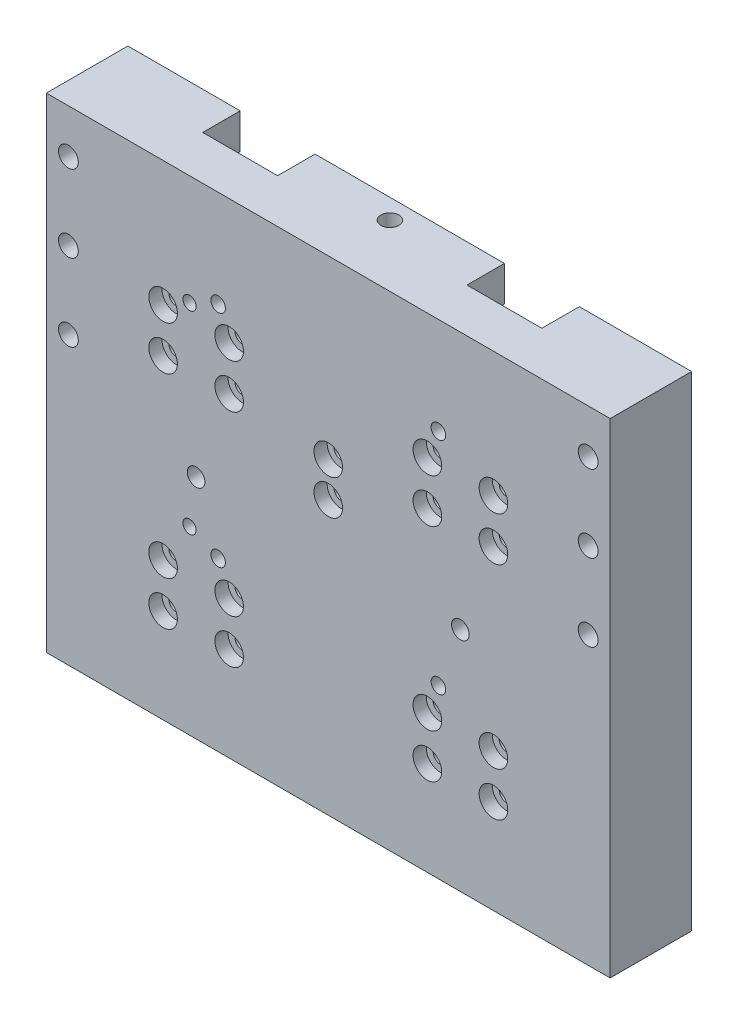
SolidWorks part; units mm, degrees
ref_plane "Front Plane" through (0, 0, 0) normal (0, 0, 1) x (1, 0, 0)
ref_plane "Top Plane" through (0, 0, 0) normal (0, 1, 0) x (1, 0, 0)
ref_plane "Right Plane" through (0, 0, 0) normal (1, 0, 0) x (0, 0, -1)
sketch "Sketch1" plane through (0, 0, 0) normal (0, 0, 1) x (1, 0, 0)
  line L1 (-64, -55) -> (64, -55)
  line L2 (-64, -55) -> (-64, 55)
  line L3 (-64, 55) -> (64, 55)
  line L4 (64, -55) -> (64, 55)
  line L5 (-64, -55) -> (64, 55) construction
  line L6 (-64, 55) -> (64, -55) construction
  point P0 (0, 0)
  dimension "D1" = 128
  dimension "D2" = 110
extrude "Boss-Extrude1" add sketch "Sketch1" along normal blind 18.5
sketch "Sketch2" plane through (0, 0, 0) normal (0, 0, -1) x (-1, 0, 0)
  line L0 (-64, 55) -> (64, 55) construction
  line L1 (-49, -52) -> (49, -52)
  line L2 (-49, -52) -> (-49, 47)
  line L3 (-49, 47) -> (49, 47)
  line L4 (49, -52) -> (49, 47)
  line L5 (64, -55) -> (-64, -55) construction
  line L6 (64, 55) -> (64, -55) construction
  line L7 (-64, -55) -> (-64, 55) construction
  dimension "D1" = 8
  dimension "D2" = 3
  dimension "D3" = 15
  dimension "D4" = 15
extrude "Cut-Extrude1" cut sketch "Sketch2" against normal blind 9.5
sketch "Sketch4" plane through (0, 55, 0) normal (0, 1, 0) x (1, 0, 0)
  line L0 (-64, 0) -> (64, 0) construction
  line L1 (-38.5, 0) -> (-21.5, 0)
  line L2 (-38.5, 0) -> (-38.5, -8.5)
  line L3 (-38.5, -8.5) -> (-21.5, -8.5)
  line L4 (-21.5, 0) -> (-21.5, -8.5)
  line L5 (-64, -18.5) -> (-64, 0) construction
  line L6 (21.5, 0) -> (38.5, 0)
  line L7 (21.5, 0) -> (21.5, -8.5)
  line L8 (21.5, -8.5) -> (38.5, -8.5)
  line L9 (38.5, 0) -> (38.5, -8.5)
  line L10 (64, -18.5) -> (64, 0) construction
  dimension "D1" = 17
  dimension "D2" = 8.5
  dimension "D3" = 25.5
  dimension "D4" = 25.5
extrude "Cut-Extrude2" cut sketch "Sketch4" against normal through all
hole_wizard "CBORE for M4 SHCS0" positions "Sketch14" profile "Sketch13" counterbore size "M4" standard "ANSI Metric"
sketch "Sketch14" plane through (0, 0, 0) normal (0, 0, -1) x (-1, 0, 0)
  line L0 (-64, -55) -> (-64, 55) construction
  line L1 (-64, 55) -> (-38.5, 55) construction
  point P0 (-59, 45)
  point P6 (-59, 27.5)
  point P8 (-59, 10)
  dimension "D1" = 5
  dimension "D2" = 5
  dimension "D3" = 5
  dimension "D4" = 10
  dimension "D5" = 27.5
  dimension "D6" = 45
sketch "Sketch13" plane through (59, 45, 0) normal (1, 0, 0) x (0, 1, 0)
  line L0 (0, 0) -> (0, 18.5)
  line L1 (0, 18.5) -> (2.25, 18.5)
  line L3 (2.25, 18.5) -> (2.25, 4)
  line L4 (2.25, 4) -> (4, 4)
  line L5 (4, 4) -> (4, 0)
  line L7 (4, 0) -> (0, 0)
  line L11 (0, -6.35) -> (0, 107.95) construction
  dimension "Thru Hole Dia." = 4.5
  dimension "Thru Hole Depth" = 18.5
  dimension "C'Bore Dia." = 8
  dimension "C'Bore Depth" = 4
mirror "Mirror1" about plane through (0, 0, 0) normal (1, 0, 0) of "CBORE for M4 SHCS0"
fillet "Fillet1" radius 4 4 edges at (-49, -52, 4.75) (-49, 47, 4.75) (49, 47, 4.75) (49, -52, 4.75)
hole_wizard "M4x0.7 Tapped Hole4" positions "Sketch24" profile "Sketch23" tap size "M4x0.7" standard "ANSI Metric"
sketch "Sketch24" plane through (0, 0, 18.5) normal (0, 0, 1) x (1, 0, 0)
  point P0 (-25, 33)
  point P3 (25, 33)
  point P6 (25, -17)
  point P9 (-25, -17)
sketch "Sketch23" plane through (-25, 33, 18.5) normal (1, 0, 0) x (0, -1, 0)
  line L0 (0, 0) -> (0, 18.5)
  line L1 (0, 18.5) -> (1.65, 18.5)
  line L2 (1.65, 18.5) -> (1.65, 0)
  line L5 (1.65, 0) -> (0, 0)
  line L11 (0, -6.35) -> (0, 107.95) construction
  dimension "Thru Tap Drill Dia." = 3.3
  dimension "Thru Tap Drill Depth" = 18.5
hole_wizard "CBORE for M3 SHCS3" positions "Sketch30" profile "Sketch29" counterbore size "M3" standard "ANSI Metric"
sketch "Sketch30" plane through (0, 0, 18.5) normal (0, 0, 1) x (1, 0, 0)
  point P0 (0, 15)
  point P3 (0, 7)
sketch "Sketch29" plane through (0, 15, 18.5) normal (1, 0, 0) x (0, -1, 0)
  line L0 (0, 0) -> (0, 18.5)
  line L1 (0, 18.5) -> (1.7, 18.5)
  line L3 (1.7, 18.5) -> (1.7, 3)
  line L4 (1.7, 3) -> (3.25, 3)
  line L5 (3.25, 3) -> (3.25, 0)
  line L7 (3.25, 0) -> (0, 0)
  line L11 (0, -6.35) -> (0, 107.95) construction
  dimension "Thru Hole Dia." = 3.4
  dimension "Thru Hole Depth" = 18.5
  dimension "C'Bore Dia." = 6.5
  dimension "C'Bore Depth" = 3
sketch "Sketch31" plane through (0, 0, 9.5) normal (0, 0, -1) x (-1, 0, 0)
  line L0 (-15, 45) -> (15, 45) construction
  line L1 (-45, -50) -> (-15, -50)
  line L2 (-45, -50) -> (-45, 45)
  line L3 (-45, 45) -> (-15, 45)
  line L4 (-15, -50) -> (-15, 45)
  line L5 (15, -50) -> (45, -50)
  line L6 (15, -50) -> (15, 45)
  line L7 (15, 45) -> (45, 45)
  line L8 (45, -50) -> (45, 45)
  line L9 (-15, -50) -> (15, -50) construction
  line L10 (-64, -55) -> (-64, 55) construction
  line L11 (64, 55) -> (64, -55) construction
  line L12 (21.5, -55) -> (-21.5, -55) construction
  dimension "D1" = 30
  dimension "D2" = 30
  dimension "D3" = 95
  dimension "D4" = 19
  dimension "D5" = 19
  dimension "D6" = 5
extrude "Cut-Extrude3" [suppressed] cut sketch "Sketch31" against normal blind 1
hole_wizard "CBORE for M3 SHCS4" positions "Sketch41" profile "Sketch40" counterbore size "M3" standard "ANSI Metric"
sketch "Sketch41" plane through (0, 0, 18.5) normal (0, 0, 1) x (1, 0, 0)
  point P0 (-37.5, 26.6)
  point P3 (-37.5, 16.6)
  point P6 (-22.5, 26.6)
  point P9 (-22.5, 16.6)
  point P12 (-37.5, -23.6)
  point P15 (-37.5, -33.6)
  point P18 (-22.5, -33.6)
  point P21 (-22.5, -23.6)
  point P24 (22.5, -23.6)
  point P27 (22.5, -33.6)
  point P30 (37.5, -33.6)
  point P33 (37.5, -23.6)
  point P36 (37.5, 16.6)
  point P39 (37.5, 26.6)
  point P42 (22.5, 26.6)
  point P45 (22.5, 16.6)
sketch "Sketch40" plane through (-37.5, 26.6, 18.5) normal (1, 0, 0) x (0, -1, 0)
  line L0 (0, 0) -> (0, 18.5)
  line L1 (0, 18.5) -> (1.7, 18.5)
  line L3 (1.7, 18.5) -> (1.7, 3)
  line L4 (1.7, 3) -> (3.25, 3)
  line L5 (3.25, 3) -> (3.25, 0)
  line L7 (3.25, 0) -> (0, 0)
  line L11 (0, -6.35) -> (0, 107.95) construction
  dimension "Thru Hole Dia." = 3.4
  dimension "Thru Hole Depth" = 18.5
  dimension "C'Bore Dia." = 6.5
  dimension "C'Bore Depth" = 3
fillet "Fillet2" [suppressed] radius 4
fillet "Fillet3" [suppressed] radius 4
fillet "Fillet4" [suppressed] radius 4
fillet "Fillet5" [suppressed] radius 4
hole_wizard "Ø4.1 (4.1) Diameter Hole1" positions "Sketch43" profile "Sketch42" hole size "Ø4.1" standard "ANSI Metric"
sketch "Sketch43" plane through (0, 55, 0) normal (0, 1, 0) x (1, 0, 0)
  line L0 (21.5, 0) -> (-21.5, 0) construction
  line L1 (0, -4.5) -> (0, 0) construction
  point P0 (0, -4.5)
  dimension "D1" = 4.5
sketch "Sketch42" plane through (0, 55, 4.5) normal (1, 0, 0) x (0, 0, 1)
  line L0 (0, 0) -> (0, 8)
  line L1 (0, 8) -> (2.05, 8)
  line L2 (2.05, 8) -> (2.05, 0)
  line L5 (2.05, 0) -> (0, 0)
  line L11 (0, -6.35) -> (0, 107.95) construction
  dimension "Thru Hole Dia." = 4.1
  dimension "Thru Hole Depth" = 8
hole_wizard "Ø3.0 (3) Diameter Hole1" positions "Sketch45" profile "Sketch44" hole size "Ø3.0" standard "ANSI Metric"
sketch "Sketch45" plane through (0, 0, 18.5) normal (0, 0, 1) x (1, 0, 0)
  line L0 (-31.5, 30) -> (-31.5, -14) construction
  line L2 (64, 55) -> (-64, 55) construction
  point P0 (-31.5, 30)
  point P2 (-31.5, -14)
  dimension "D1" = 31.5
  dimension "D2" = 25
  dimension "D3" = 44
sketch "Sketch44" plane through (-31.5, 30, 18.5) normal (1, 0, 0) x (0, -1, 0)
  line L0 (0, 0) -> (0, 18.5)
  line L1 (0, 18.5) -> (1.5, 18.5)
  line L2 (1.5, 18.5) -> (1.5, 0)
  line L5 (1.5, 0) -> (0, 0)
  line L11 (0, -6.35) -> (0, 107.95) construction
  dimension "Thru Hole Dia." = 3
  dimension "Thru Hole Depth" = 18.5
hole_wizard "Ø4.0 (4) Diameter Hole1" positions "Sketch47" profile "Sketch46" hole size "Ø4.0" standard "ANSI Metric"
sketch "Sketch47" plane through (0, 0, 18.5) normal (0, 0, 1) x (1, 0, 0)
  line L0 (-30, -3.5) -> (30, -3.5) construction
  line L2 (-30, -3.5) -> (-30, 16.6) construction
  line L4 (-37.5, 16.6) -> (-30, 16.6) construction
  line L5 (-30, 16.6) -> (-22.5, 16.6) construction
  line L7 (30, -3.5) -> (30, 16.6) construction
  line L8 (30, 16.6) -> (37.5, 16.6) construction
  line L10 (30, 16.6) -> (22.5, 16.6) construction
  line L12 (-30, -3.5) -> (-30, -23.6) construction
  line L13 (-30, -23.6) -> (-37.5, -23.6) construction
  point P0 (-30, -3.5)
  point P2 (30, -3.5)
sketch "Sketch46" plane through (-30, -3.5, 18.5) normal (1, 0, 0) x (0, -1, 0)
  line L0 (0, 0) -> (0, 18.5)
  line L1 (0, 18.5) -> (2, 18.5)
  line L2 (2, 18.5) -> (2, 0)
  line L5 (2, 0) -> (0, 0)
  line L11 (0, -6.35) -> (0, 107.95) construction
  dimension "Thru Hole Dia." = 4
  dimension "Thru Hole Depth" = 18.5
